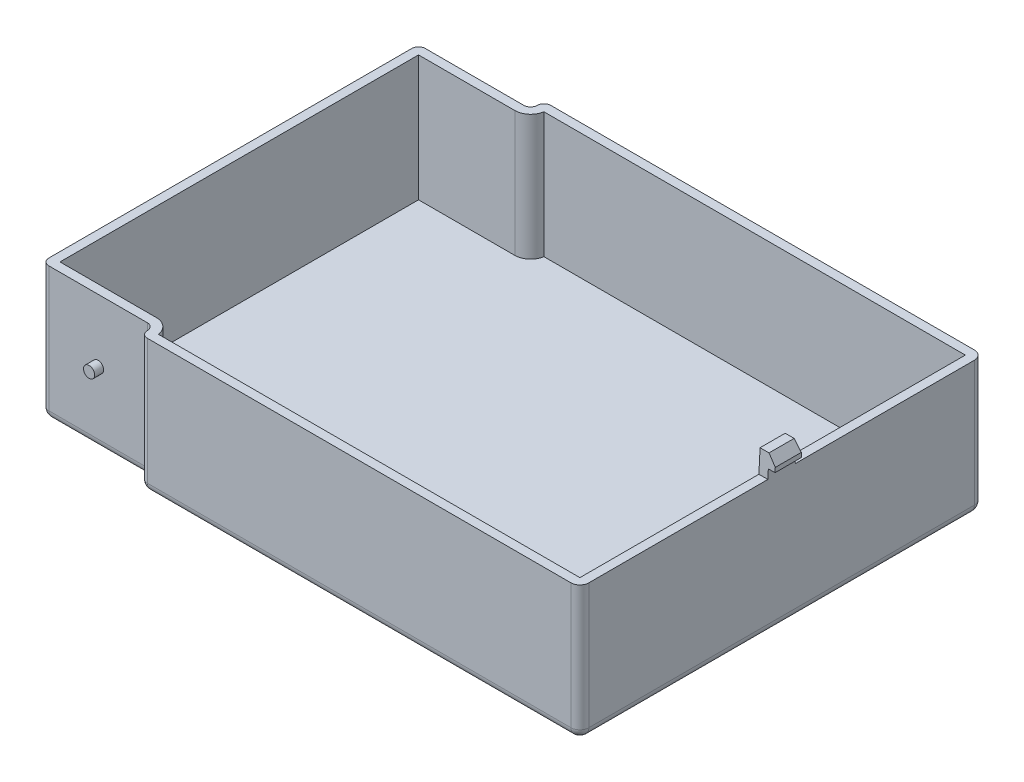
SolidWorks part; units mm, degrees
other "<snap-hook-2>-<Lip5>"
ref_plane "Front Plane" through (0, 0, 0) normal (0, 0, 1) x (1, 0, 0)
ref_plane "Top Plane" through (0, 0, 0) normal (0, 1, 0) x (1, 0, 0)
ref_plane "Right Plane" through (0, 0, 0) normal (1, 0, 0) x (0, 0, -1)
sketch "Sketch1" plane through (0, 0, 0) normal (0, 1, 0) x (1, 0, 0)
  line L0 (-36.5, 45) -> (-36.5, 42)
  line L1 (-36.5, -45) -> (61.5, -45)
  line L2 (-61.5, -42) -> (-61.5, 42)
  line L3 (-36.5, 45) -> (61.5, 45)
  line L4 (61.5, -45) -> (61.5, 45)
  line L5 (-36.5, 42) -> (-61.5, 42)
  line L6 (-61.5, 0) -> (61.5, 0) construction
  line L8 (-36.5, -42) -> (-61.5, -42)
  line L9 (-36.5, -45) -> (-36.5, -42)
  dimension "D1" = 123
  dimension "D2" = 3
  dimension "D3" = 90
  dimension "D4" = 25
extrude "Extrude1" add sketch "Sketch1" along normal blind 30
fillet "Fillet1" radius 1.5 6 edges at (-36.5, 15, -45) (-36.5, 15, 45) (-36.5, 15, -42) (-61.5, 15, -42) (-61.5, 15, 42) (-36.5, 15, 42)
fillet "Fillet3" radius 2 2 edges at (61.5, 15, -45) (61.5, 15, 45)
fillet "Fillet2" radius 2 14 edges at (12.25, 0, -45) (-36.0607, 0, -44.5607) (-36.9393, 0, -42.4393) (-49, 0, -42) (-61.0607, 0, -41.5607) (-61.5, 0, 0) (-61.0607, 0, 41.5607) (-49, 0, 42) (-36.9393, 0, 42.4393) (-36.0607, 0, 44.5607) (61.5, 0, 0) (12.25, 0, 45) (60.9142, 0, -44.4142) (60.9142, 0, 44.4142)
shell "Shell1" thickness 2
sketch "Sketch2" plane through (0, 0, 42) normal (0, 0, 1) x (1, 0, 0)
  line L0 (-60, 30) -> (-38, 2) construction
  circle A0 centre (-49, 16) radius 1.25
  dimension "D1" = 2.5
extrude "Extrude2" add sketch "Sketch2" along normal blind 2
mirror "Mirror1" about plane through (0, 0, 0) normal (0, 0, 1) of "Extrude2"
sketch3d "3DSketch1"
  point P0 (61.5, 30, 0)
other "Snap Hook1" parameters "BaseDepth"=2, "TopDepth"=2, "Width"=5.6, "HookHeight"=3, "Overhang"=1.5, "BodyHeight"=2, "Draft"=3, "LipHeight"=1
inserted part "snap-hook-2"
move or copy body "Body-Move/Copy2" placed by mates yes
other "SnapGroove1" parameters "HeightOffset"=0, "WidthOffset"=0, "Clearance"=0, "Gap"=0, "GapHeight"=2
move or copy body "Body-Move/Copy3" bodies to move or copy 104 copy no rotation origin (-49, 16, 0) rotation axis (0, 0, 1) rotation angle 160
delete or keep bodies "Body-Delete1" type delete bodies bodies 105
